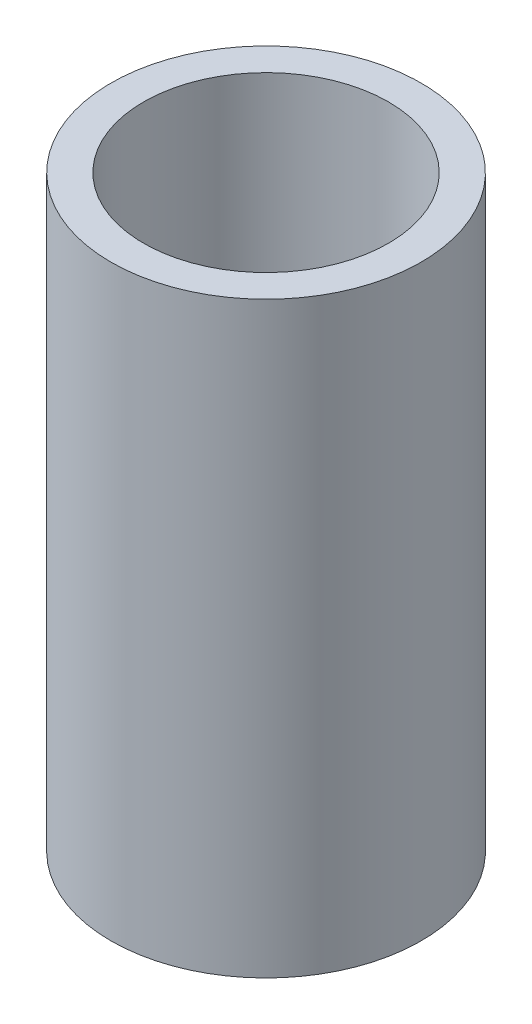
SolidWorks part; units mm, degrees
ref_plane "Front Plane" through (0, 0, 0) normal (0, 0, 1) x (1, 0, 0)
ref_plane "Top Plane" through (0, 0, 0) normal (0, 1, 0) x (1, 0, 0)
ref_plane "Right Plane" through (0, 0, 0) normal (1, 0, 0) x (0, 0, -1)
sketch "Sketch3" plane through (0, 0, 0) normal (0, 1, 0) x (1, 0, 0)
  circle A0 centre (0, 0) radius 30.1625
extrude "Extrude1" add sketch "Sketch3" along normal blind 114.3
sketch "Sketch4" plane through (0, 0, 0) normal (0, -1, 0) x (1, 0, 0)
  circle A0 centre (0, 0) radius 23.8125
extrude "Cut-Extrude1" cut sketch "Sketch4" against normal blind 114.3
